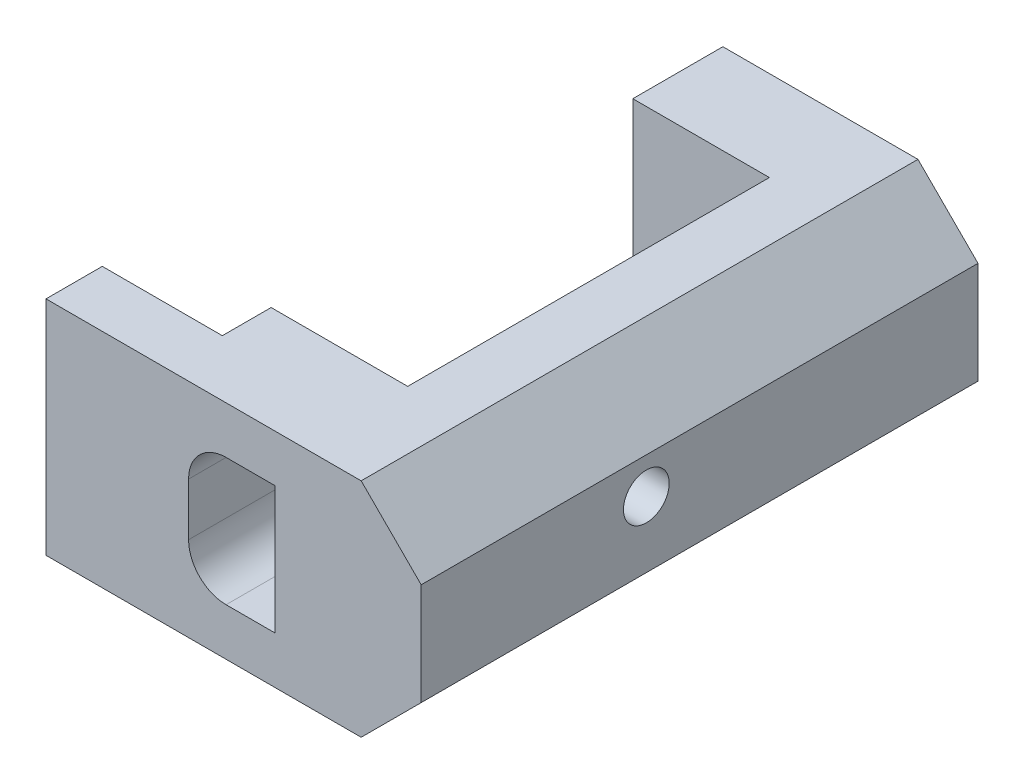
SolidWorks part; units mm, degrees
ref_plane "Front" through (0, 0, 0) normal (0, 0, 1) x (1, 0, 0)
ref_plane "Top" through (0, 0, 0) normal (0, 1, 0) x (1, 0, 0)
ref_plane "Right" through (0, 0, 0) normal (1, 0, 0) x (0, 0, -1)
sketch "Sketch1" plane through (0, 0, 0) normal (0, 1, 0) x (1, 0, 0)
  line L0 (0, 0) -> (13, 0)
  line L1 (13, 0) -> (13, 33.1)
  line L2 (0, 0) -> (0, 5)
  line L3 (0, 5) -> (9.1, 5)
  line L4 (9.1, 5) -> (9.1, 28.1)
  line L5 (13, 16.55) -> (-7.0543, 16.55) construction
  line L6 (0, 28.1) -> (9.1, 28.1)
  line L7 (0, 33.1) -> (0, 28.1)
  line L8 (0, 33.1) -> (13, 33.1)
  point P12 (9.1, 16.55)
  dimension "D1" = 5
  dimension "D2" = 13
  dimension "D3" = 9.1
  dimension "D4" = 16.55
extrude "Boss-Extrude1" add sketch "Sketch1" along normal blind 14.8
sketch "Sketch3" plane through (13, 0, 0) normal (1, 0, 0) x (0, 0, -1)
  line L0 (28.1, 0) -> (5, 0) construction
  line L1 (0, 14.8) -> (0, 0) construction
  circle A0 centre (12, 8.4) radius 1.5
  dimension "D1" = 3
  dimension "D2" = 12
  dimension "D3" = 8.4
extrude "Cut-Extrude2" cut sketch "Sketch3" against normal blind 10
sketch "Sketch5" plane through (9.1, 0, 0) normal (-1, 0, 0) x (0, 0, 1)
  line L1 (-11.7386, 11.6896) -> (-14.7182, 10.2712)
  line L2 (-14.7182, 10.2712) -> (-14.9796, 6.9815)
  line L3 (-14.9796, 6.9815) -> (-12.2614, 5.1104)
  line L4 (-12.2614, 5.1104) -> (-9.2818, 6.5288)
  line L5 (-9.2818, 6.5288) -> (-9.0204, 9.8185)
  line L6 (-9.0204, 9.8185) -> (-11.7386, 11.6896)
  circle A0 centre (-12, 8.4) radius 2.8579 construction
  dimension "D1" = 6.6
extrude "Cut-Extrude4" cut sketch "Sketch5" against normal blind 2.5
sketch "Sketch7" plane through (0, 0, 0) normal (0, 0, 1) x (1, 0, 0)
  line L0 (0, 0) -> (12.9, 0)
  line L1 (12.9, 0) -> (13, 0.1)
  line L2 (13, 0.1) -> (13, 14.7)
  line L3 (13, 14.7) -> (12.9, 14.8)
  line L4 (12.9, 14.8) -> (0, 14.8)
  line L5 (0, 14.8) -> (0, 0)
  line L8 (12.9, 14.8) -> (13, 14.8)
  line L9 (13, 14.8) -> (13, 14.7)
  line L10 (12.9, 14.8) -> (13, 14.7)
  line L11 (13, 14.8) -> (12.9, 14.8)
  line L12 (13, 14.8) -> (13, 14.7)
  line L13 (12.9, 0) -> (13, 0)
  line L14 (13, 0) -> (13, 0.1)
  line L15 (12.9, 0) -> (13, 0.1)
extrude "Boss-Extrude2" add sketch "Sketch7" along normal blind 3 contours L1 M5 M1 | L3 M1 M3 | L3 L1 M1 M3 M4 M5
sketch "Sketch6" plane through (0, 0, 0) normal (-1, 0, 0) x (0, 0, 1)
  line L0 (-5, 14.8) -> (3, 14.8) construction
  line L1 (-5, 0) -> (-0.75, 0)
  line L2 (-5, 0) -> (-5, 14.8)
  line L3 (-5, 14.8) -> (-0.75, 14.8)
  line L4 (-0.75, 0) -> (-0.75, 14.8)
  line L9 (-0.75, 0) -> (-0.75, 14.8)
  line L10 (-0.75, 14.8) -> (3, 14.8)
  line L11 (-0.75, 14.8) -> (-0.75, 0)
  line L12 (-0.75, 0) -> (3, 0)
  line L13 (3, 14.8) -> (3, 0)
  dimension "D1" = 4.25
extrude "Boss-Extrude3" add sketch "Sketch6" along normal blind 8
sketch "Sketch8" plane through (0, 0, 3) normal (0, 0, 1) x (1, 0, 0)
  line L0 (-8, 0) -> (12.9, 0) construction
  line L5 (7.25, 11.65) -> (7.25, 3.15)
  line L6 (7.25, 3.15) -> (4, 3.15)
  line L7 (1.5, 9.15) -> (1.5, 5.65)
  line L8 (7.25, 11.65) -> (4, 11.65)
  line L10 (13, 0.1) -> (13, 14.7) construction
  arc A0 (4, 11.65) -> (1.5, 9.15) centre (4, 9.15) ccw
  arc A1 (1.5, 5.65) -> (4, 3.15) centre (4, 5.65) ccw
  point P12 (1.5, 3.15)
  dimension "D5" = 2.5
  dimension "D1" = 8.5
  dimension "D2" = 3.15
  dimension "D3" = 5.75
  dimension "D4" = 5.75
extrude "Cut-Extrude7" cut sketch "Sketch8" against normal blind 8
sketch "Sketch10" plane through (0, 0, -33.1) normal (0, 0, -1) x (-1, 0, 0)
  line L0 (0, 14.8) -> (0, 0)
  line L1 (0, 0) -> (-12.9, 0)
  line L2 (-12.9, 0) -> (-13, 0.1)
  line L3 (-13, 0.1) -> (-13, 14.7)
  line L4 (-13, 14.7) -> (-12.9, 14.8)
  line L5 (-12.9, 14.8) -> (0, 14.8)
  line L6 (-13, 0.1) -> (-13, 0)
  line L7 (-13, 0) -> (-12.9, 0)
  line L8 (-13, 14.7) -> (-13, 14.8)
  line L9 (-13, 14.8) -> (-12.9, 14.8)
extrude "Boss-Extrude4" add sketch "Sketch10" along normal blind 1 contours L4 M3 M1 | L4 L2 M3 M5 M6 M1 | L2 M5 M3
sketch "Sketch11" plane through (0, 0, 0) normal (-1, 0, 0) x (0, 0, 1)
  circle A0 centre (-31.1, 8.4) radius 1
  dimension "D1" = 2
extrude "Cut-Extrude8" cut sketch "Sketch11" against normal blind 6
sketch "Sketch12" plane through (0, 0, -5) normal (0, 0, -1) x (-1, 0, 0)
  line L0 (0, 14.8) -> (0, 0)
  line L1 (0, 0) -> (-9.1, 0)
  line L2 (-9.1, 0) -> (-9.1, 14.8)
  line L3 (-9.1, 14.8) -> (0, 14.8)
extrude "Cut-Extrude9" cut sketch "Sketch12" against normal blind 1
sketch "Sketch15" plane through (13, 0, 0) normal (1, 0, 0) x (0, 0, -1)
  line L0 (-3, 14.8) -> (34.1, 14.8)
  line L1 (34.1, 14.8) -> (34.1, 0)
  line L2 (34.1, 0) -> (-3, 0)
  line L3 (-3, 0) -> (-3, 14.8)
extrude "Boss-Extrude5" add sketch "Sketch15" along normal blind 4
chamfer "Chamfer1" distance 4 angle 45 2 edges at (17, 0, -15.55) (17, 14.8, -15.55)
sketch "Sketch16" plane through (17, 0, 0) normal (1, 0, 0) x (0, 0, -1)
  line L0 (-3, 10.8) -> (-3, 4) construction
  line L1 (34.1, 0) -> (-3, 0) construction
  circle A0 centre (12, 8.4) radius 1.525
  dimension "D1" = 3.05
  dimension "D2" = 15
  dimension "D3" = 8.4
extrude "Cut-Extrude10" cut sketch "Sketch16" against normal through all
